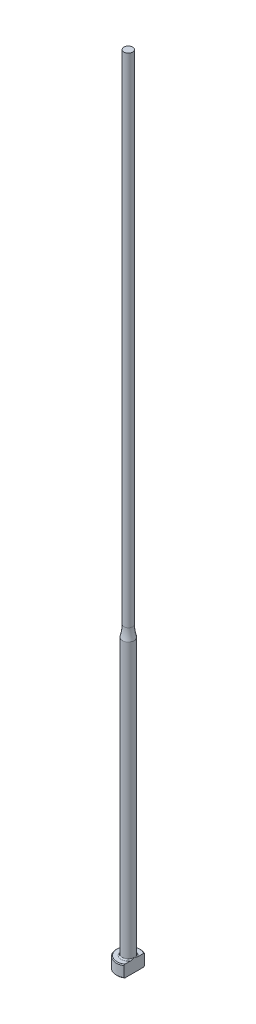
SolidWorks part; units mm, degrees
ref_plane "Front Plane" through (0, 0, 0) normal (0, 0, 1) x (1, 0, 0)
ref_plane "Top Plane" through (0, 0, 0) normal (0, 1, 0) x (1, 0, 0)
ref_plane "Right Plane" through (0, 0, 0) normal (1, 0, 0) x (0, 0, -1)
sketch "Sketch1" plane through (0, 0, 0) normal (0, 0, 1) x (1, 0, 0)
  line L0 (0, 259.9588) -> (0, -15.1925) construction
  line L1 (0, 0) -> (-3, 0)
  line L2 (-3, 0) -> (-3, 3)
  line L3 (-3, 3) -> (-1.5, 3)
  line L4 (-1.1, 75) -> (-1.1, 200)
  line L5 (-1.1, 200) -> (0, 200)
  line L6 (0, 200) -> (0, 0)
  line L7 (-1.5, 3) -> (-1.5, 72.2)
  arc A0 (-1.5, 72.2) -> (-1.1, 75) centre (-11.1, 75) ccw
  point P13 (-1.5, 0)
  dimension "D1" = 10
  dimension "L" = 200
  dimension "H" = 6
  dimension "T" = 3
  dimension "D" = 2.2
  dimension "B" = 3
  dimension "S" = 75
revolve "Revolve1" add sketch "Sketch1" angle 360 about L0
chamfer "Chamfer1" distance 0.2 angle 45 2 edges at (0, 3, 3) (0, 0, 3)
fillet "Fillet1" radius 0.3 1 edges at (0, 3, 1.5)
sketch "Sketch2" plane through (0, 0, 0) normal (0, 1, 0) x (1, 0, 0)
  line L0 (1.5, 2.5981) -> (1.5, -2.5981)
  circle A0 centre (0, 0) radius 3 construction
  arc A1 (1.5, -2.5981) -> (1.5, 2.5981) centre (0, 0) ccw
  circle A2 centre (0, 0) radius 1.5 construction
extrude "KEY" cut sketch "Sketch2" along normal through all
